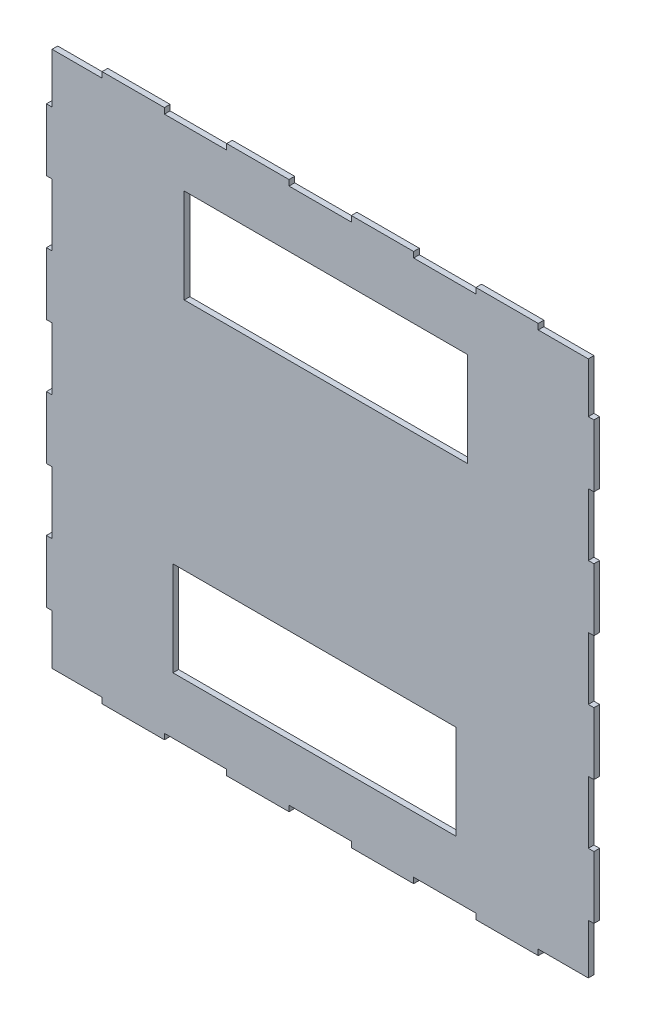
SolidWorks part; units mm, degrees
ref_plane "Front Plane" through (0, 0, 0) normal (0, 0, 1) x (1, 0, 0)
ref_plane "Top Plane" through (0, 0, 0) normal (0, 1, 0) x (1, 0, 0)
ref_plane "Right Plane" through (0, 0, 0) normal (1, 0, 0) x (0, 0, -1)
sketch "Sketch1" plane through (0, 0, 0) normal (0, 0, 1) x (1, 0, 0)
  line L0 (0, 0) -> (0, 26.5)
  line L1 (0, 26.5) -> (3, 26.5)
  line L2 (3, 26.5) -> (3, 59.5)
  line L3 (3, 59.5) -> (0, 59.5)
  line L4 (0, 59.5) -> (0, 92.5)
  line L5 (0, 92.5) -> (3, 92.5)
  line L6 (3, 92.5) -> (3, 125.5)
  line L7 (3, 125.5) -> (0, 125.5)
  line L8 (0, 125.5) -> (0, 158.5)
  line L9 (0, 158.5) -> (3, 158.5)
  line L10 (3, 158.5) -> (3, 191.5)
  line L11 (3, 191.5) -> (0, 191.5)
  line L12 (0, 191.5) -> (0, 224.5)
  line L13 (0, 224.5) -> (3, 224.5)
  line L14 (3, 224.5) -> (3, 257.5)
  line L15 (3, 257.5) -> (0, 257.5)
  line L16 (0, 257.5) -> (0, 284)
  line L17 (0, 284) -> (-26.5, 284)
  line L18 (-26.5, 284) -> (-26.5, 287)
  line L19 (-26.5, 287) -> (-59.5, 287)
  line L20 (-59.5, 287) -> (-59.5, 284)
  line L21 (-59.5, 284) -> (-92.5, 284)
  line L22 (-92.5, 284) -> (-92.5, 287)
  line L23 (-92.5, 287) -> (-125.5, 287)
  line L24 (-125.5, 287) -> (-125.5, 284)
  line L25 (-125.5, 284) -> (-158.5, 284)
  line L26 (-158.5, 284) -> (-158.5, 287)
  line L27 (-158.5, 287) -> (-191.5, 287)
  line L28 (-191.5, 287) -> (-191.5, 284)
  line L29 (-191.5, 284) -> (-224.5, 284)
  line L30 (-224.5, 284) -> (-224.5, 287)
  line L31 (-224.5, 287) -> (-257.5, 287)
  line L32 (-257.5, 287) -> (-257.5, 284)
  line L33 (-257.5, 284) -> (-284, 284)
  line L34 (-284, 284) -> (-284, 257.5)
  line L35 (-284, 257.5) -> (-287, 257.5)
  line L36 (-287, 257.5) -> (-287, 224.5)
  line L37 (-287, 224.5) -> (-284, 224.5)
  line L38 (-284, 224.5) -> (-284, 191.5)
  line L39 (-284, 191.5) -> (-287, 191.5)
  line L40 (-287, 191.5) -> (-287, 158.5)
  line L41 (-287, 158.5) -> (-284, 158.5)
  line L42 (-284, 158.5) -> (-284, 125.5)
  line L43 (-284, 125.5) -> (-287, 125.5)
  line L44 (-287, 125.5) -> (-287, 92.5)
  line L45 (-287, 92.5) -> (-284, 92.5)
  line L46 (-284, 92.5) -> (-284, 59.5)
  line L47 (-284, 59.5) -> (-287, 59.5)
  line L48 (-287, 59.5) -> (-287, 26.5)
  line L49 (-287, 26.5) -> (-284, 26.5)
  line L50 (-284, 26.5) -> (-284, 0)
  line L51 (-284, 0) -> (-257.5, 0)
  line L52 (-257.5, 0) -> (-257.5, -3)
  line L53 (-257.5, -3) -> (-224.5, -3)
  line L54 (-224.5, -3) -> (-224.5, 0)
  line L55 (-224.5, 0) -> (-191.5, 0)
  line L56 (-191.5, 0) -> (-191.5, -3)
  line L57 (-191.5, -3) -> (-158.5, -3)
  line L58 (-158.5, -3) -> (-158.5, 0)
  line L59 (-158.5, 0) -> (-125.5, 0)
  line L60 (-125.5, 0) -> (-125.5, -3)
  line L61 (-125.5, -3) -> (-92.5, -3)
  line L62 (-92.5, -3) -> (-92.5, 0)
  line L63 (-92.5, 0) -> (-59.5, 0)
  line L64 (-59.5, 0) -> (-59.5, -3)
  line L65 (-59.5, -3) -> (-26.5, -3)
  line L66 (-26.5, -3) -> (-26.5, 0)
  line L67 (-26.5, 0) -> (0, 0)
  line L69 (-214, 254) -> (-64, 254)
  line L70 (-214, 254) -> (-214, 204)
  line L71 (-214, 204) -> (-64, 204)
  line L72 (-64, 254) -> (-64, 204)
  line L73 (-220, 80) -> (-70, 80)
  line L74 (-220, 80) -> (-220, 30)
  line L75 (-220, 30) -> (-70, 30)
  line L76 (-70, 80) -> (-70, 30)
  dimension "D1" = 26.5
  dimension "D2" = 3
  dimension "D3" = 33
  dimension "D4" = 26.5
  dimension "D5" = 26.5
  dimension "D6" = 33
  dimension "D7" = 3
  dimension "D8" = 3
  dimension "D9" = 26.5
  dimension "D10" = 26.5
  dimension "D11" = 26.5
  dimension "D12" = 33
  dimension "D13" = 3
  dimension "D14" = 26.5
  dimension "D15" = 26.5
  dimension "D16" = 33
  dimension "D17" = 33
  dimension "D18" = 33
  dimension "D19" = 33
  dimension "D20" = 33
  dimension "D21" = 33
  dimension "D22" = 33
  dimension "D23" = 3
  dimension "D24" = 3
  dimension "D25" = 3
  dimension "D26" = 3
  dimension "D27" = 50
  dimension "D28" = 150
  dimension "D29" = 64
  dimension "D30" = 30
  dimension "D31" = 150
  dimension "D32" = 50
  dimension "D33" = 64
  dimension "D34" = 30
extrude "Boss-Extrude1" add sketch "Sketch1" along normal blind 3
